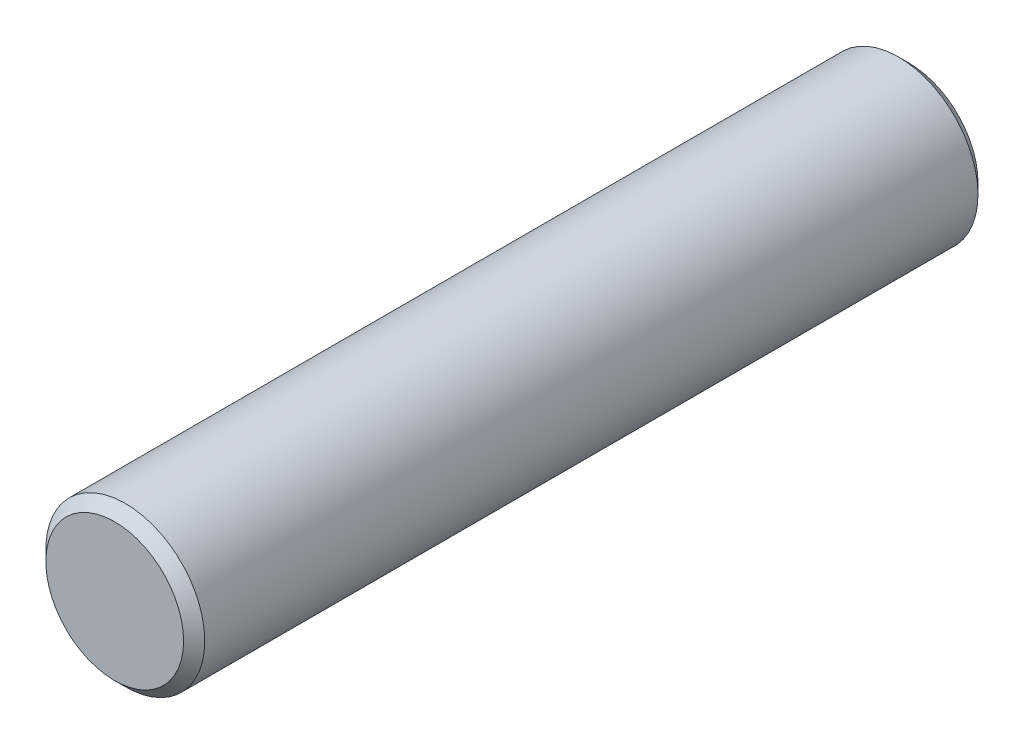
SolidWorks part; units mm, degrees
ref_plane "Face" through (0, 0, 0) normal (0, 0, 1) x (1, 0, 0)
ref_plane "Dessus" through (0, 0, 0) normal (0, 1, 0) x (1, 0, 0)
ref_plane "Droite" through (0, 0, 0) normal (1, 0, 0) x (0, 0, -1)
sketch "Esquisse1" plane through (0, 0, 0) normal (0, 0, 1) x (1, 0, 0)
  circle A0 centre (0, 0) radius 7.5
  dimension "D1" = 15
extrude "Base-Extrusion" add sketch "Esquisse1" along normal blind 75
chamfer "Chanfrein1" distance 1 angle 45 2 edges at (7.5, 0, 0) (7.5, 0, 75)
